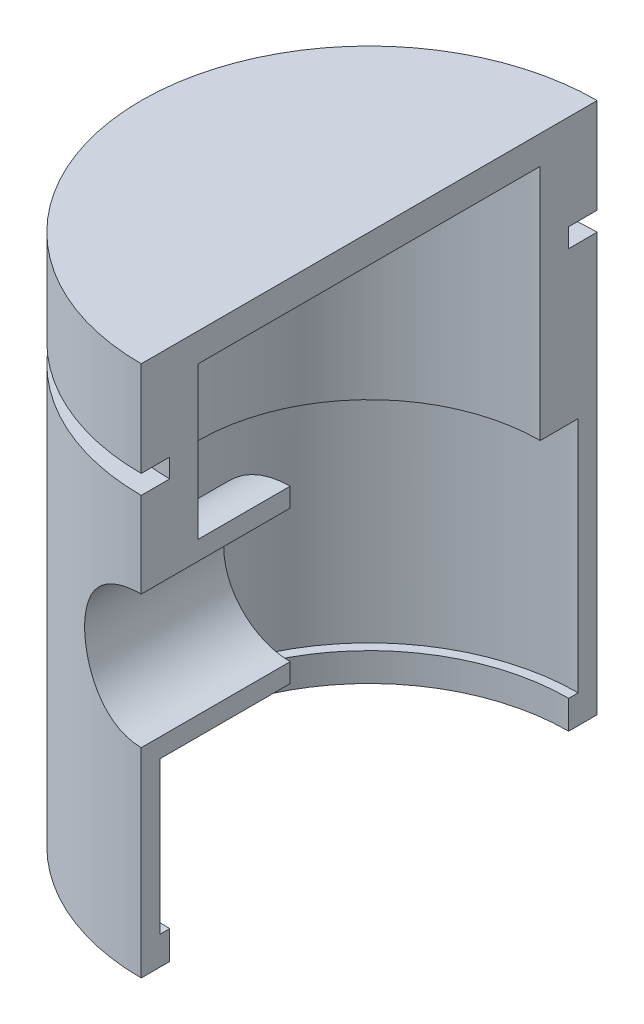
SolidWorks part; units mm, degrees
ref_plane "Front" through (0, 0, 0) normal (0, 0, 1) x (1, 0, 0)
ref_plane "Top" through (0, 0, 0) normal (0, 1, 0) x (1, 0, 0)
ref_plane "Right" through (0, 0, 0) normal (1, 0, 0) x (0, 0, -1)
sketch "Sketch1" plane through (0, 0, 0) normal (1, 0, 0) x (0, 0, -1)
  line L0 (38.1, 88.9) -> (0, 88.9)
  line L1 (0, 88.9) -> (0, 84.1375)
  line L2 (0, 84.1375) -> (28.575, 84.1375)
  line L3 (28.575, 84.1375) -> (28.575, 44.45)
  line L4 (28.575, 44.45) -> (34.925, 44.45)
  line L5 (34.925, 44.45) -> (34.925, 4.7625)
  line L6 (34.925, 4.7625) -> (33.3375, 4.7625)
  line L7 (33.3375, 4.7625) -> (33.3375, 0)
  line L8 (33.3375, 0) -> (38.1, 0)
  line L9 (38.1, 0) -> (38.1, 88.9)
  line L10 (0, 88.9) -> (0, 0) construction
  dimension "D1" = 28.575
  dimension "D2" = 33.3375
  dimension "D3" = 34.925
  dimension "D4" = 38.1
  dimension "D5" = 4.7625
  dimension "D6" = 44.45
  dimension "D7" = 84.1375
  dimension "D8" = 88.9
revolve "Piston" add sketch "Sketch1" angle 180 about L10
ref_plane "Plano medio" through (0, 0, 13.208) normal (0, 0, 1) x (1, 0, 0)
sketch "Sketch5" plane through (0, 0, 13.208) normal (0, 0, 1) x (1, 0, 0)
  line L0 (0, -55.9859) -> (0, 55.9859) construction
  line L1 (-38.1, 0) -> (0, 0) construction
  line L2 (0, 0) -> (0, 88.9) construction
  line L3 (0, 30.1625) -> (0, 58.7375)
  arc A0 (0, 58.7375) -> (0, 30.1625) centre (0, 44.45) ccw
  dimension "D2" = 28.575
  dimension "D1" = 44.45
extrude "Saliente circular" add sketch "Sketch5" along normal up to next
sketch "Sketch6" plane through (0, 0, 13.208) normal (0, 0, 1) x (1, 0, 0)
  circle A0 centre (0, 44.45) radius 11.1125
  dimension "D1" = 22.225
extrude "Corte circular lateral" cut sketch "Sketch6" along normal through all
sketch "Sketch7" plane through (0, 7.4473, 55.2427) normal (1, 0, 0) x (0, 0, -1)
  line L0 (93.3427, 62.4027) -> (93.3427, 65.5777)
  line L1 (93.3427, 65.5777) -> (88.5802, 65.5777)
  line L2 (88.5802, 65.5777) -> (88.5802, 62.4027)
  line L3 (88.5802, 62.4027) -> (93.3427, 62.4027)
  line L4 (55.2427, 65.5777) -> (55.2427, 62.4027) construction
  line L7 (93.3427, -7.4473) -> (93.3427, 81.4527) construction
  dimension "D1" = 33.3375
  dimension "D2" = 38.1
  dimension "D3" = 3.175
  dimension "D4" = 69.85
revolve "Ranura" cut sketch "Sketch7" angle 360 about L4
